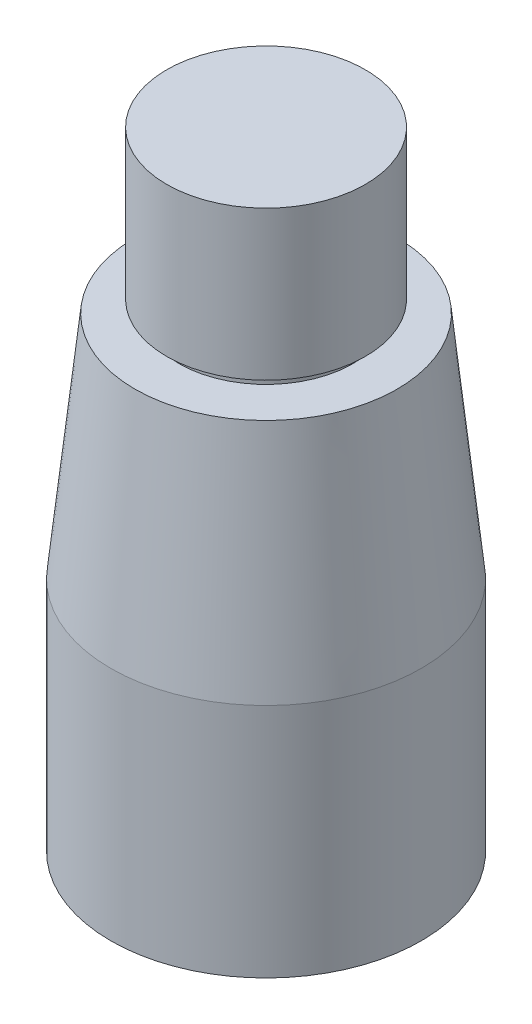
SolidWorks part; units mm, degrees
ref_plane "Front Plane" through (0, 0, 0) normal (0, 0, 1) x (1, 0, 0)
ref_plane "Top Plane" through (0, 0, 0) normal (0, 1, 0) x (1, 0, 0)
ref_plane "Right Plane" through (0, 0, 0) normal (1, 0, 0) x (0, 0, -1)
sketch "Sketch1" plane through (0, 0, 0) normal (0, 0, 1) x (1, 0, 0)
  line L0 (0, 85.1026) -> (0, 0) construction
  line L1 (0, 0) -> (-12.5, 0)
  line L2 (-12.5, 0) -> (-12.5, 19)
  line L3 (-12.5, 19) -> (-10.5556, 37.5)
  line L4 (-10.5556, 37.5) -> (-7, 37.5)
  line L5 (-7, 37.5) -> (-7, 38.5)
  line L6 (-7, 38.5) -> (-8, 38.5)
  line L7 (-8, 38.5) -> (-8, 50.5)
  line L8 (-8, 50.5) -> (0, 50.5)
  line L9 (0, 0) -> (0, 50.5)
  dimension "D1" = 50.5
  dimension "D2" = 1
  dimension "D3" = 19
  dimension "D4" = 6
  dimension "D5" = 12
  dimension "D6" = 12.5
  dimension "D7" = 8
  dimension "D8" = 1
revolve "Revolve1" add sketch "Sketch1" angle 360 about L0
